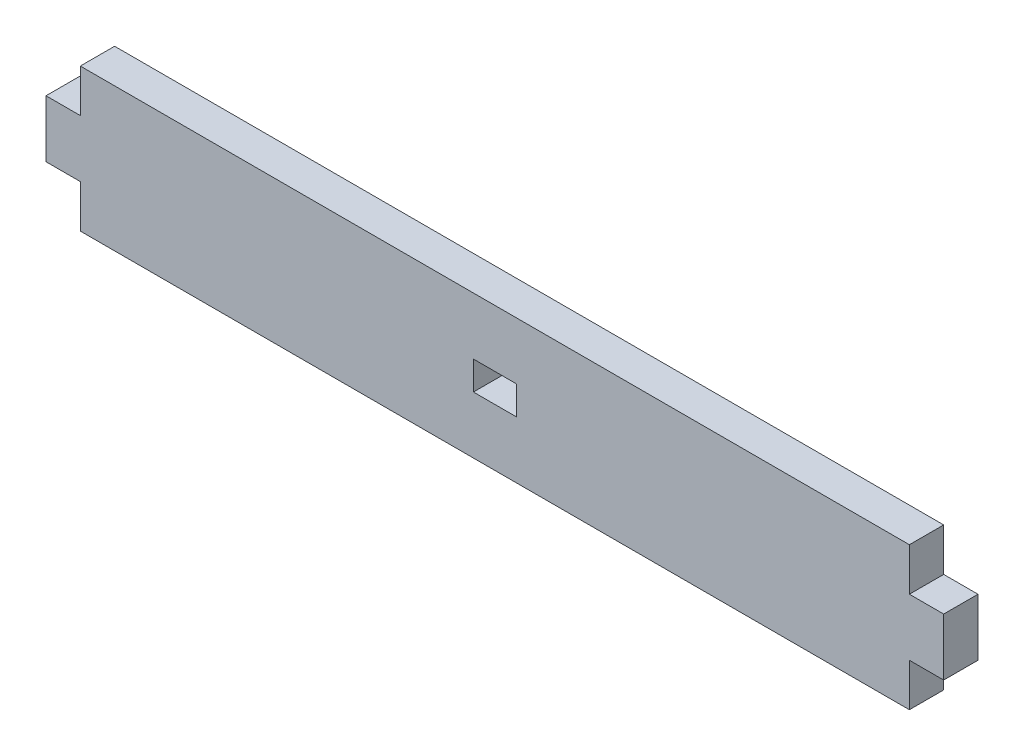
SolidWorks part; units mm, degrees
ref_plane "Front Plane" through (0, 0, 0) normal (0, 0, 1) x (1, 0, 0)
ref_plane "Top Plane" through (0, 0, 0) normal (0, 1, 0) x (1, 0, 0)
ref_plane "Right Plane" through (0, 0, 0) normal (1, 0, 0) x (0, 0, -1)
sketch "Sketch1" plane through (0, 0, 0) normal (0, 0, 1) x (1, 0, 0)
  line L0 (-145, 25) -> (-145, 10)
  line L1 (-145, 25) -> (145, 25)
  line L3 (-145, -25) -> (145, -25)
  line L5 (-145, 10) -> (-157, 10)
  line L6 (-157, 10) -> (-157, -10)
  line L7 (-157, -10) -> (-145, -10)
  line L8 (-145, -10) -> (-145, -25)
  line L9 (145, 25) -> (145, 10)
  line L10 (145, 10) -> (157, 10)
  line L11 (157, 10) -> (157, -10)
  line L12 (157, -10) -> (145, -10)
  line L13 (145, -10) -> (145, -25)
  line L15 (-7.5, 5) -> (7.5, 5)
  line L16 (-7.5, 5) -> (-7.5, -5)
  line L17 (-7.5, -5) -> (7.5, -5)
  line L18 (7.5, 5) -> (7.5, -5)
  point P4 (0, -25)
  point P14 (-157, 0)
  point P19 (-7.5, 0)
  point P20 (0, 5)
  dimension "D1" = 314
  dimension "D2" = 12
  dimension "D3" = 15
  dimension "D4" = 20
  dimension "D5" = 15
  dimension "D6" = 10
extrude "Boss-Extrude1" add sketch "Sketch1" against normal blind 12
sketch "Sketch2" plane through (0, 0, -12) normal (0, 0, -1) x (-1, 0, 0)
  circle A0 centre (-45, 0) radius 4.7
  circle A1 centre (45, 0) radius 4.7
  dimension "D1" = 9.4
  dimension "D2" = 90
extrude "Cut-Extrude1" cut sketch "Sketch2" against normal blind 5
